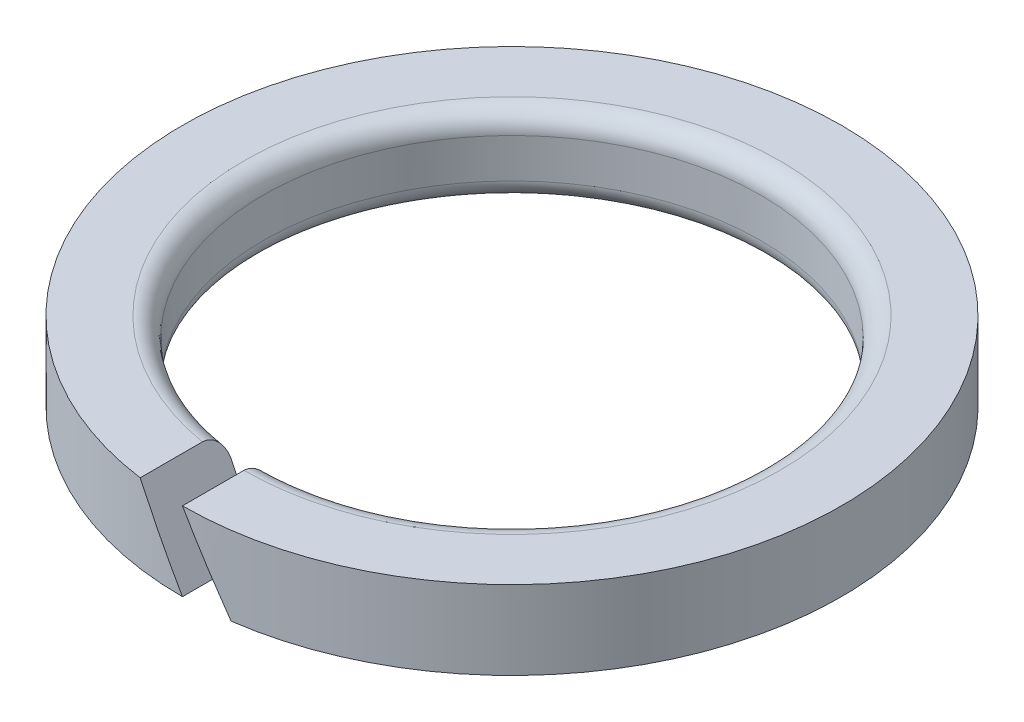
SolidWorks part; units mm, degrees
ref_plane "Front Plane" through (0, 0, 0) normal (0, 0, 1) x (1, 0, 0)
ref_plane "Top Plane" through (0, 0, 0) normal (0, 1, 0) x (1, 0, 0)
ref_plane "Right Plane" through (0, 0, 0) normal (1, 0, 0) x (0, 0, -1)
other "Configuration Table"
sketch "BodySke" plane through (0, 0, 0) normal (0, 1, 0) x (1, 0, 0)
  circle A0 centre (0, 0) radius 25.25
  circle A1 centre (0, 0) radius 33.5
  dimension "Inner_dia" = 50.5
  dimension "Outer_dia" = 67
extrude "BaseBody" add sketch "BodySke" along normal blind 8
sketch "SlitSke" plane through (0, 0, 0) normal (0, 0, 1) x (1, 0, 0)
  line L0 (0, 0) -> (-4.6188, 8)
  line L1 (25.25, 8) -> (-25.25, 8) construction
  line L2 (-4.6188, 8) -> (0, 8)
  line L3 (0, 8) -> (4.6188, 0)
  line L4 (-33.5, 0) -> (33.5, 0) construction
  line L5 (4.6188, 0) -> (0, 0)
  dimension "Angle" = 120
extrude "Slit" cut sketch "SlitSke" along normal through all
fillet "Fillet1" radius 2 2 edges at (-2.3192, 0, -25.1433) (2.3192, 8, -25.1433)
